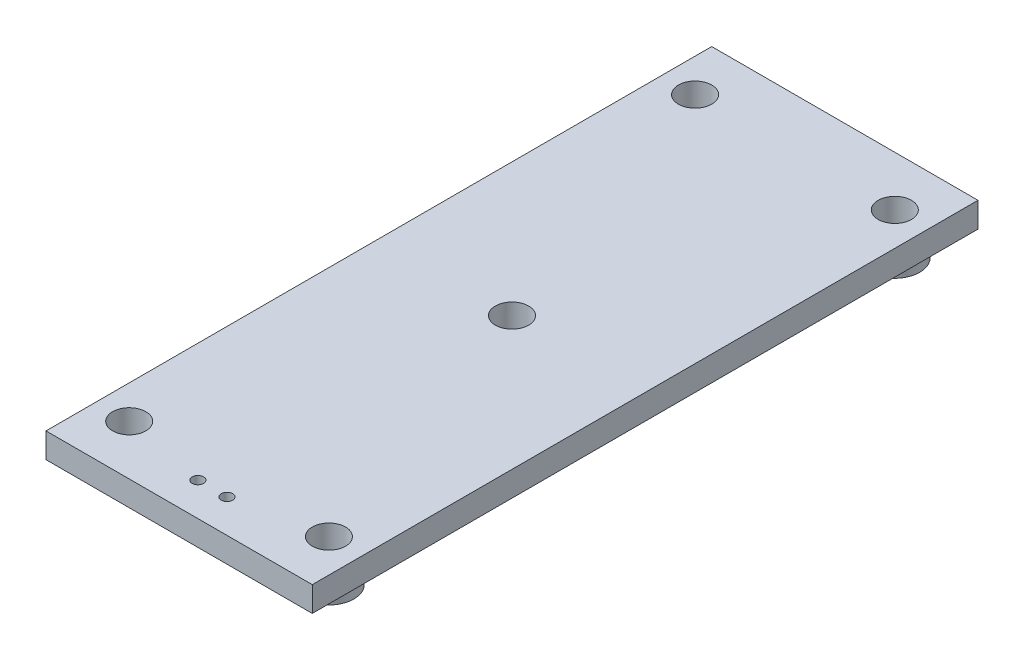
SolidWorks part; units mm, degrees
ref_plane "front" through (0, 0, 0) normal (0, 0, 1) x (1, 0, 0)
ref_plane "top" through (0, 0, 0) normal (0, 1, 0) x (1, 0, 0)
ref_plane "side" through (0, 0, 0) normal (1, 0, 0) x (0, 0, -1)
sketch "Sketch1" plane through (0, 0, 0) normal (0, 1, 0) x (1, 0, 0)
  line L0 (101.6, 0) -> (-101.6, 0)
  line L1 (101.6, 0) -> (101.6, -508)
  line L2 (-101.6, -508) -> (101.6, -508)
  line L3 (-101.6, -508) -> (-101.6, 0)
  line L4 (0, 0) -> (0, -508) construction
  dimension "D1" = 508
  dimension "D2" = 203.2
extrude "Base-Extrude" add sketch "Sketch1" along normal blind 19.05
sketch "Sketch2" plane through (0, 0, 0) normal (0, -1, 0) x (1, 0, 0)
  line L0 (0, 508) -> (0, 254) construction
  line L1 (-101.6, 508) -> (101.6, 508) construction
  line L2 (101.6, 254) -> (0, 254) construction
  line L3 (101.6, 0) -> (101.6, 508) construction
  circle A0 centre (76.2, 469.9) radius 19.05
  circle A1 centre (76.2, 38.1) radius 19.05
  circle A2 centre (-76.2, 38.1) radius 19.05
  circle A3 centre (-76.2, 469.9) radius 19.05
  dimension "D2" = 38.1
  dimension "D1" = 38.1
  dimension "D3" = 152.4
extrude "Boss-Extrude1" add sketch "Sketch2" along normal blind 12.7
sketch "Sketch3" plane through (0, -12.7, 0) normal (0, -1, 0) x (1, 0, 0)
  circle A0 centre (76.2, 469.9) radius 12.7
  circle A2 centre (-76.2, 469.9) radius 12.7
  circle A3 centre (76.2, 38.1) radius 12.7
  circle A4 centre (-76.2, 38.1) radius 12.7
  circle A5 centre (-76.2, 38.1) radius 19.05 construction
  circle A6 centre (76.2, 38.1) radius 19.05 construction
  dimension "D1" = 25.4
extrude "Cut-Extrude1" cut sketch "Sketch3" against normal through all
sketch "Sketch4" plane through (0, 19.05, 0) normal (0, 1, 0) x (-1, 0, 0)
  line L0 (0, 254) -> (-101.6, 254) construction
  line L1 (-101.6, 0) -> (-101.6, 508) construction
  circle A0 centre (0, 254) radius 12.7
  dimension "D1" = 25.4
extrude "Cut-Extrude2" cut sketch "Sketch4" against normal through all
sketch "Sketch5" plane through (0, 0, 0) normal (0, -1, 0) x (1, 0, 0)
  circle A2 centre (11.1125, 482.6) radius 4.3656
  circle A3 centre (-11.1125, 482.6) radius 4.3656
  dimension "D1" = 8.7312
extrude "Cut-Extrude3" cut sketch "Sketch5" against normal through all
